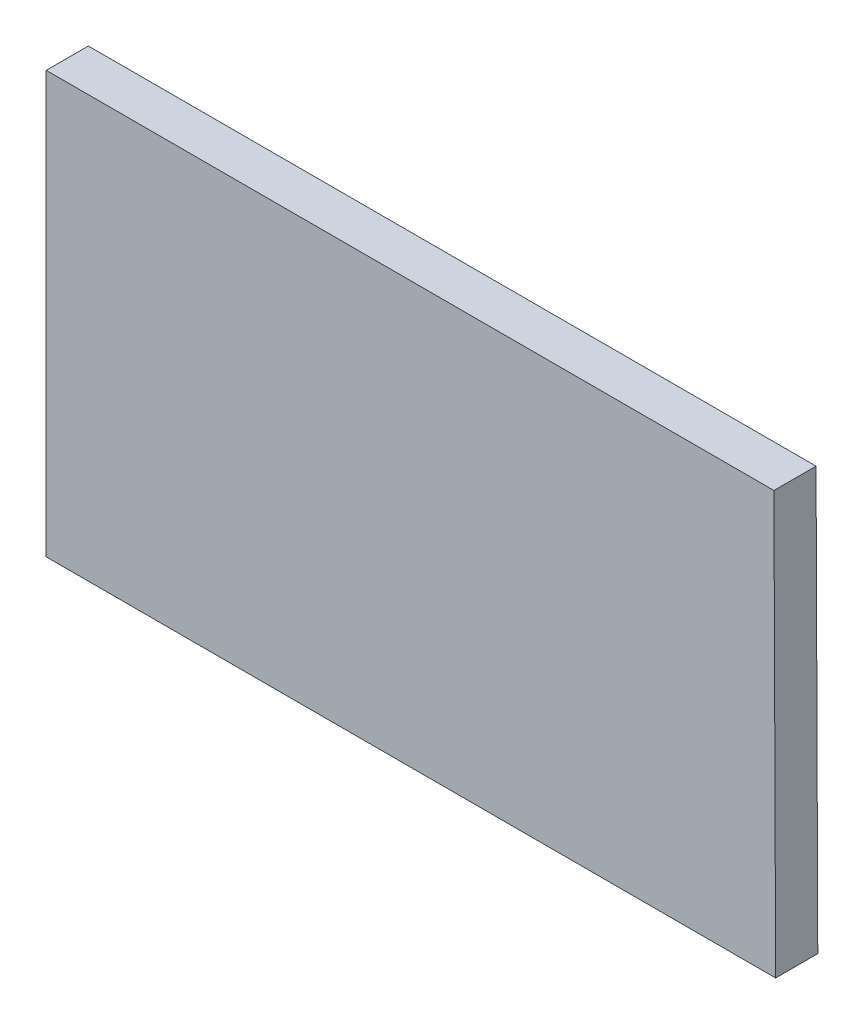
SolidWorks part; units mm, degrees
ref_plane "Front" through (0, 0, 0) normal (0, 0, 1) x (1, 0, 0)
ref_plane "Top" through (0, 0, 0) normal (0, 1, 0) x (1, 0, 0)
ref_plane "Right" through (0, 0, 0) normal (1, 0, 0) x (0, 0, -1)
sketch "Sketch1" plane through (0, 0, 0) normal (0, 0, 1) x (1, 0, 0)
  line L0 (-17.3116, -10) -> (17.3116, -10)
  line L1 (17.3116, -10) -> (17.2303, 10)
  line L2 (17.2303, 10) -> (-17.3116, 10)
  line L3 (-17.3116, 10) -> (-17.3116, -10)
extrude "Boss-Extrude1" add sketch "Sketch1" along normal blind 2
